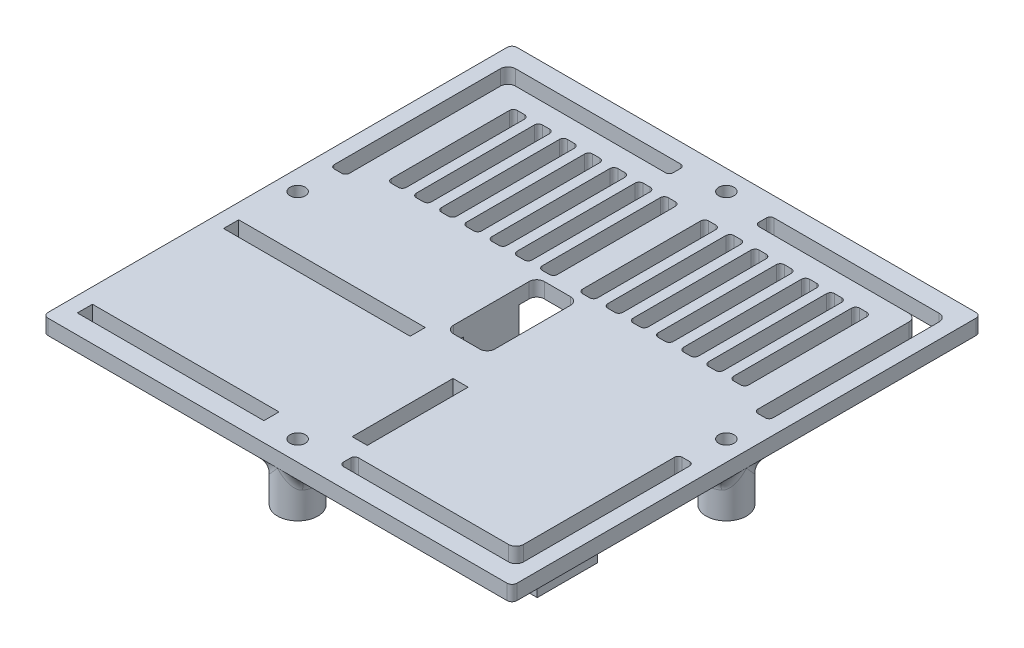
SolidWorks part; units mm, degrees
ref_plane "Front Plane" through (0, 0, 0) normal (0, 0, 1) x (1, 0, 0)
ref_plane "Top Plane" through (0, 0, 0) normal (0, 1, 0) x (1, 0, 0)
ref_plane "Right Plane" through (0, 0, 0) normal (1, 0, 0) x (0, 0, -1)
sketch "Sketch1" plane through (0, 0, 0) normal (0, 1, 0) x (1, 0, 0)
  line L0 (0, 0) -> (0, 42.5) construction
  circle A0 centre (0, 42.5) radius 4
  circle A1 centre (0, 0) radius 42.5 construction
  circle A2 centre (42.5, 0) radius 4
  circle A3 centre (0, -42.5) radius 4
  circle A4 centre (-42.5, 0) radius 4
  point P13 (0, 0)
  dimension "D1" = 8
  dimension "D2" = 42.5
  dimension "D3" = 4
extrude "Boss-Extrude1" add sketch "Sketch1" along normal blind 22
sketch "Sketch3" plane through (0, 0, 0) normal (0, -1, 0) x (-1, 0, 0)
  circle A0 centre (0, 42.5) radius 2.6
  circle A1 centre (0, 42.5) radius 4
  circle A2 centre (0, 42.5) radius 4 construction
  circle A3 centre (0, 0) radius 42.5 construction
  circle A4 centre (42.5, 0) radius 2.6
  circle A5 centre (42.5, 0) radius 4
  circle A6 centre (0, -42.5) radius 2.6
  circle A7 centre (0, -42.5) radius 4
  circle A8 centre (-42.5, 0) radius 2.6
  circle A9 centre (-42.5, 0) radius 4
  point P21 (0, 0)
  dimension "D1" = 5.2
  dimension "D2" = 4
extrude "Boss-Extrude2" add sketch "Sketch3" along normal blind 2
sketch "Sketch4" plane through (0, 22, 0) normal (0, 1, 0) x (1, 0, 0)
  circle A0 centre (0, 0) radius 42.5 construction
  circle A1 centre (0, -42.5) radius 1.5
  circle A2 centre (-42.5, 0) radius 1.5
  circle A3 centre (0, 42.5) radius 1.5
  circle A4 centre (42.5, 0) radius 1.5
  point P15 (0, 0)
  dimension "D1" = 3
  dimension "D2" = 4
extrude "Cut-Extrude1" cut sketch "Sketch4" against normal up to surface (22 mm away)
ref_plane "Plane1" through (0, 1.25, 0) normal (0, -1, 0) x (-1, 0, 0)
sketch "Sketch5" plane through (0, 1.25, 0) normal (0, -1, 0) x (-1, 0, 0)
  line L1 (46.5, 46.5) -> (-46.5, 46.5)
  line L2 (46.5, 46.5) -> (46.5, -46.5)
  line L3 (46.5, -46.5) -> (-46.5, -46.5)
  line L4 (-46.5, 46.5) -> (-46.5, -46.5)
  line L5 (46.5, 46.5) -> (-46.5, -46.5) construction
  line L6 (46.5, -46.5) -> (-46.5, 46.5) construction
  circle A0 centre (-42.5, 0) radius 4 construction
  circle A3 centre (0, -42.5) radius 4 construction
  point P0 (0, 0)
extrude "Boss-Extrude3" add sketch "Sketch5" against normal blind 3
sketch "Sketch7" plane through (0, 1.25, 0) normal (0, -1, 0) x (1, 0, 0)
  line L0 (0, 5.5) -> (0, -5.5) construction
  line L1 (0, 0) -> (4.1, 0) construction
  line L2 (4.1, 5.5) -> (5.6, 5.5)
  line L3 (4.1, 5.5) -> (-4.1, 5.5) construction
  line L4 (4.1, 5.5) -> (4.1, -5.5)
  line L5 (4.1, -5.5) -> (-4.1, -5.5) construction
  line L6 (-4.1, 5.5) -> (-4.1, -5.5)
  line L9 (4.1, 5.5) -> (-4.1, -5.5) construction
  line L10 (4.1, -5.5) -> (-4.1, 5.5) construction
  line L11 (5.6, 5.5) -> (5.6, -5.5)
  line L12 (5.6, -5.5) -> (4.1, -5.5)
  line L13 (-4.1, 5.5) -> (-5.6, 5.5)
  line L14 (-5.6, 5.5) -> (-5.6, -5.5)
  line L15 (-5.6, -5.5) -> (-4.1, -5.5)
  line L16 (-4.1, -5.5) -> (-4.0641, -5.4662)
  dimension "D1" = 5.5
  dimension "D2" = 4.1
  dimension "D3" = 1.5
  dimension "D4" = 1.5
extrude "Boss-Extrude4" add sketch "Sketch7" along normal blind 10 contours L6 L13 L14 L15 | L11 L12 L4 L2
sketch "Sketch8" plane through (0, 1.25, 0) normal (0, -1, 0) x (1, 0, 0)
  line L0 (-46.5, 46.5) -> (-46.5, 0) construction
  line L1 (-46.5, 39.7) -> (-6.5, 39.7)
  line L2 (-46.5, 39.7) -> (-46.5, 36.7)
  line L3 (-46.5, 36.7) -> (-6.5, 36.7)
  line L4 (-6.5, 39.7) -> (-6.5, 36.7)
  line L5 (0, 46.5) -> (-46.5, 46.5) construction
  line L6 (-46.5, 26.7) -> (3.5, 26.7) construction
  line L7 (-46.5, 13.7) -> (-46.5, 16.7)
  line L8 (-6.5, 13.7) -> (-6.5, 16.7)
  line L9 (-46.5, 13.7) -> (-6.5, 13.7)
  line L10 (-46.5, 16.7) -> (-6.5, 16.7)
  line L12 (5, 16.7) -> (2, 16.7)
  line L13 (5, 16.7) -> (5, 36.7)
  line L14 (5, 36.7) -> (2, 36.7)
  line L15 (2, 16.7) -> (2, 36.7)
  line L16 (5, 16.7) -> (2, 36.7) construction
  line L17 (5, 36.7) -> (2, 16.7) construction
  point P4 (0, 0)
  point P5 (40.5, 0)
  point P6 (0, 0)
  point P14 (44.5, 0)
  dimension "D3" = 40
  dimension "D4" = 10
  dimension "D5" = 50
  dimension "D1" = 9.8
  dimension "D2" = 3
  dimension "D6" = 3
  dimension "D7" = 20
extrude "Boss-Extrude5" add sketch "Sketch8" along normal blind 3
sketch "Sketch9" plane through (0, -8.75, 0) normal (0, -1, 0) x (1, 0, 0)
  line L0 (0, 0) -> (0, -5.5) construction
  line L1 (-5.6, -5.5) -> (5.6, -5.5)
  line L2 (-5.6, -5.5) -> (-5.6, 5.5)
  line L3 (-5.6, 5.5) -> (5.6, 5.5)
  line L4 (5.6, -5.5) -> (5.6, 5.5)
  line L5 (4.1, 5.5) -> (4.1, -5.5) construction
  line L6 (4.1, -3.1) -> (-4.1, -3.1)
  line L7 (4.1, -3.1) -> (4.1, -4.2)
  line L8 (4.1, -4.2) -> (-4.1, -4.2)
  line L9 (-4.1, -3.1) -> (-4.1, -4.2)
  line L10 (4.1, -3.1) -> (-4.1, -4.2) construction
  line L11 (4.1, -4.2) -> (-4.1, -3.1) construction
  line L12 (0, 0) -> (4.1, 0) construction
  line L13 (4.1, 4.2) -> (-4.1, 3.1) construction
  line L14 (4.1, 3.1) -> (-4.1, 4.2) construction
  line L15 (-4.1, 3.1) -> (-4.1, 4.2)
  line L16 (4.1, 3.1) -> (4.1, 4.2)
  line L17 (4.1, 4.2) -> (-4.1, 4.2)
  line L18 (4.1, 3.1) -> (-4.1, 3.1)
  point P9 (0, -3.65)
  dimension "D1" = 1.1
  dimension "D2" = 3.1
extrude "Boss-Extrude6" add sketch "Sketch9" along normal blind 1.5
sketch "Sketch10" plane through (0, 1.25, 0) normal (0, -1, 0) x (1, 0, 0)
  line L0 (2, 26.7) -> (-46.5, 26.7) construction
  line L1 (2, 36.7) -> (2, 16.7) construction
  line L2 (-46.5, 36.7) -> (-46.5, 16.7) construction
  line L3 (46.5, 0) -> (46.5, 46.5) construction
  line L4 (-46.5, 46.5) -> (-46.5, 39.7) construction
  line L5 (8.5, -40.45) -> (8.5, -41.95)
  line L6 (-6.5, 39.7) -> (-43.5, 39.7)
  line L7 (-6.5, 39.7) -> (-6.5, 42.7)
  line L8 (43.5, 39.7) -> (43.5, 8.25)
  line L9 (-6.5, 42.7) -> (-43.5, 42.7)
  line L10 (-43.5, 39.7) -> (-43.5, 42.7)
  line L11 (-43.5, 13.7) -> (-43.5, 10.7)
  line L12 (-6.5, 13.7) -> (-43.5, 13.7)
  line L13 (-6.5, 13.7) -> (-6.5, 10.7)
  line L14 (-6.5, 10.7) -> (-43.5, 10.7)
  line L15 (2, 26.7) -> (5, 26.7) construction
  line L16 (5, 16.7) -> (5, 36.7) construction
  line L17 (5, 16.7) -> (5, 36.7) construction
  line L18 (5, 36.7) -> (8, 36.7)
  line L19 (5, 36.7) -> (5, 16.7)
  line L20 (5, 16.7) -> (8, 16.7)
  line L21 (8, 36.7) -> (8, 16.7)
  line L22 (4.1, 5.5) -> (4.1, -5.5) construction
  line L23 (-2.6, -9) -> (2.6, -9)
  line L24 (-4.1, -7.5) -> (-4.1, 7.5)
  line L25 (-2.6, 9) -> (2.6, 9)
  line L26 (4.1, -7.5) -> (4.1, 7.5)
  line L27 (-4.1, -9) -> (4.1, 9) construction
  line L28 (-4.1, 9) -> (4.1, -9) construction
  line L29 (0, 0) -> (46.5, 0) construction
  line L30 (42.75, 7.5) -> (41.25, 7.5)
  line L31 (40.5, 38.2) -> (40.5, 8.25)
  line L32 (42.75, -7.5) -> (41.25, -7.5)
  line L33 (39, 39.7) -> (9.25, 39.7)
  line L34 (43.5, 39.7) -> (43.5, 41.2)
  line L35 (42, 42.7) -> (9.25, 42.7)
  line L36 (8.5, 40.45) -> (8.5, 41.95)
  line L37 (43.5, -39.7) -> (43.5, -41.2)
  line L38 (43.5, -39.7) -> (43.5, -8.25)
  line L39 (40.5, -38.2) -> (40.5, -8.25)
  line L40 (42, -42.7) -> (9.25, -42.7)
  line L41 (39, -39.7) -> (9.25, -39.7)
  line L42 (0, 0) -> (0, -42.5) construction
  line L43 (-39, -39.7) -> (-9.25, -39.7)
  line L44 (-42, -42.7) -> (-9.25, -42.7)
  line L45 (-40.5, -38.2) -> (-40.5, -8.25)
  line L46 (-43.5, -39.7) -> (-43.5, -8.25)
  line L47 (-43.5, -39.7) -> (-43.5, -41.2)
  line L48 (-42.75, -7.5) -> (-41.25, -7.5)
  line L49 (-8.5, -40.45) -> (-8.5, -41.95)
  arc A0 (-2.6, -9) -> (-4.1, -7.5) centre (-2.6, -7.5) cw
  arc A1 (2.6, -9) -> (4.1, -7.5) centre (2.6, -7.5) ccw
  arc A2 (2.6, 9) -> (4.1, 7.5) centre (2.6, 7.5) cw
  arc A3 (-4.1, 7.5) -> (-2.6, 9) centre (-2.6, 7.5) cw
  circle A4 centre (42.5, 0) radius 4 construction
  arc A5 (43.5, 41.2) -> (42, 42.7) centre (42, 41.2) ccw
  arc A6 (39, 39.7) -> (40.5, 38.2) centre (39, 38.2) cw
  arc A7 (9.25, 42.7) -> (8.5, 41.95) centre (9.25, 41.95) ccw
  arc A8 (9.25, 39.7) -> (8.5, 40.45) centre (9.25, 40.45) cw
  arc A9 (41.25, 7.5) -> (40.5, 8.25) centre (41.25, 8.25) cw
  arc A10 (43.5, 8.25) -> (42.75, 7.5) centre (42.75, 8.25) cw
  arc A11 (9.25, -39.7) -> (8.5, -40.45) centre (9.25, -40.45) ccw
  arc A12 (9.25, -42.7) -> (8.5, -41.95) centre (9.25, -41.95) cw
  arc A13 (41.25, -7.5) -> (40.5, -8.25) centre (41.25, -8.25) ccw
  arc A14 (43.5, -8.25) -> (42.75, -7.5) centre (42.75, -8.25) ccw
  arc A15 (39, -39.7) -> (40.5, -38.2) centre (39, -38.2) ccw
  arc A16 (43.5, -41.2) -> (42, -42.7) centre (42, -41.2) cw
  arc A17 (-43.5, -41.2) -> (-42, -42.7) centre (-42, -41.2) ccw
  arc A18 (-39, -39.7) -> (-40.5, -38.2) centre (-39, -38.2) cw
  arc A19 (-43.5, -8.25) -> (-42.75, -7.5) centre (-42.75, -8.25) cw
  arc A20 (-41.25, -7.5) -> (-40.5, -8.25) centre (-41.25, -8.25) cw
  arc A21 (-9.25, -42.7) -> (-8.5, -41.95) centre (-9.25, -41.95) ccw
  arc A22 (-9.25, -39.7) -> (-8.5, -40.45) centre (-9.25, -40.45) cw
  point P29 (0, 0)
  point P61 (43.5, 42.7)
  point P64 (40.5, 39.7)
  point P67 (8.5, 42.7)
  point P72 (40.5, 7.5)
  point P75 (43.5, 7.5)
  dimension "D5" = 1.5
  dimension "D13" = 1.5
  dimension "D14" = 0.75
  dimension "D1" = 3
  dimension "D2" = 3
  dimension "D3" = 3
  dimension "D4" = 18
  dimension "D6" = 3
  dimension "D7" = 3
  dimension "D8" = 32.2
  dimension "D9" = 7.5
  dimension "D10" = 3
  dimension "D11" = 35
  dimension "D12" = 32.2
extrude "Cut-Extrude2" cut sketch "Sketch10" against normal through all
fillet "Fillet1" radius 5 2 edges at (-5.6, 1.25, 0) (5.6, 1.25, 0)
sketch "Sketch11" plane through (-46.5, 0, 0) normal (-1, 0, 0) x (0, 0, 1)
  line L1 (-46.5, 4.25) -> (46.5, 4.25)
  line L2 (-46.5, 4.25) -> (-46.5, 22)
  line L3 (-46.5, 22) -> (46.5, 22)
  line L4 (46.5, 4.25) -> (46.5, 22)
extrude "Cut-Extrude3" cut sketch "Sketch11" against normal through all both and the other way through all
sketch "Sketch12" plane through (0, -2, 0) normal (0, -1, 0) x (1, 0, 0)
  line L0 (0, 0) -> (0, 42.5) construction
  circle A0 centre (0, 42.5) radius 4
  circle A1 centre (0, 42.5) radius 2.6
  circle A2 centre (42.5, 0) radius 2.6
  circle A3 centre (42.5, 0) radius 4
  circle A4 centre (0, -42.5) radius 2.6
  circle A5 centre (0, -42.5) radius 4
  circle A6 centre (-42.5, 0) radius 2.6
  circle A7 centre (-42.5, 0) radius 4
  point P19 (0, 0)
  dimension "D1" = 5.2
  dimension "D2" = 8
  dimension "D3" = 4
extrude "Boss-Extrude7" add sketch "Sketch12" along normal blind 5
sketch "Sketch13" plane through (0, 1.25, 0) normal (0, -1, 0) x (1, 0, 0)
  line L0 (-40.5, -38.2) -> (-40.5, -8.25) construction
  line L1 (-23.2941, -35.7) -> (-24.7059, -35.7)
  line L2 (-22.5, -34.9059) -> (-22.5, -11.4941)
  line L3 (-23.2941, -10.7) -> (-24.7059, -10.7)
  line L4 (-25.5, -34.9059) -> (-25.5, -11.4941)
  line L5 (-9.25, -39.7) -> (-39, -39.7) construction
  line L6 (-17.5, -34.9059) -> (-17.5, -11.4941)
  line L7 (-18.2941, -10.7) -> (-19.7059, -10.7)
  line L8 (-20.5, -34.9059) -> (-20.5, -11.4941)
  line L9 (-18.2941, -35.7) -> (-19.7059, -35.7)
  line L10 (-12.5, -34.9059) -> (-12.5, -11.4941)
  line L11 (-13.2941, -10.7) -> (-14.7059, -10.7)
  line L12 (-15.5, -34.9059) -> (-15.5, -11.4941)
  line L13 (-13.2941, -35.7) -> (-14.7059, -35.7)
  line L14 (-7.5, -34.9059) -> (-7.5, -11.4941)
  line L15 (-8.2941, -10.7) -> (-9.7059, -10.7)
  line L16 (-10.5, -34.9059) -> (-10.5, -11.4941)
  line L17 (-8.2941, -35.7) -> (-9.7059, -35.7)
  line L18 (-2.5, -34.9059) -> (-2.5, -11.4941)
  line L19 (-3.2941, -10.7) -> (-4.7059, -10.7)
  line L20 (-5.5, -34.9059) -> (-5.5, -11.4941)
  line L21 (-3.2941, -35.7) -> (-4.7059, -35.7)
  line L22 (-27.4684, -34.9059) -> (-27.4684, -11.4941)
  line L23 (-28.2625, -10.7) -> (-29.6744, -10.7)
  line L24 (-28.2625, -35.7) -> (-29.6744, -35.7)
  line L25 (-30.4684, -34.9059) -> (-30.4684, -11.4941)
  line L26 (-32.4369, -34.9059) -> (-32.4369, -11.4941)
  line L27 (-33.2309, -10.7) -> (-34.6428, -10.7)
  line L28 (-33.2309, -35.7) -> (-34.6428, -35.7)
  line L29 (-35.4369, -34.9059) -> (-35.4369, -11.4941)
  line L30 (0, 0) -> (0, -42.5) construction
  line L31 (35.4369, -34.9059) -> (35.4369, -11.4941)
  line L32 (33.2309, -35.7) -> (34.6428, -35.7)
  line L33 (33.2309, -10.7) -> (34.6428, -10.7)
  line L34 (32.4369, -34.9059) -> (32.4369, -11.4941)
  line L35 (30.4684, -34.9059) -> (30.4684, -11.4941)
  line L36 (28.2625, -35.7) -> (29.6744, -35.7)
  line L37 (28.2625, -10.7) -> (29.6744, -10.7)
  line L38 (27.4684, -34.9059) -> (27.4684, -11.4941)
  line L39 (3.2941, -35.7) -> (4.7059, -35.7)
  line L40 (5.5, -34.9059) -> (5.5, -11.4941)
  line L41 (3.2941, -10.7) -> (4.7059, -10.7)
  line L42 (2.5, -34.9059) -> (2.5, -11.4941)
  line L43 (8.2941, -35.7) -> (9.7059, -35.7)
  line L44 (10.5, -34.9059) -> (10.5, -11.4941)
  line L45 (8.2941, -10.7) -> (9.7059, -10.7)
  line L46 (7.5, -34.9059) -> (7.5, -11.4941)
  line L47 (13.2941, -35.7) -> (14.7059, -35.7)
  line L48 (15.5, -34.9059) -> (15.5, -11.4941)
  line L49 (13.2941, -10.7) -> (14.7059, -10.7)
  line L50 (12.5, -34.9059) -> (12.5, -11.4941)
  line L51 (18.2941, -35.7) -> (19.7059, -35.7)
  line L52 (20.5, -34.9059) -> (20.5, -11.4941)
  line L53 (18.2941, -10.7) -> (19.7059, -10.7)
  line L54 (17.5, -34.9059) -> (17.5, -11.4941)
  line L55 (25.5, -34.9059) -> (25.5, -11.4941)
  line L56 (23.2941, -10.7) -> (24.7059, -10.7)
  line L57 (22.5, -34.9059) -> (22.5, -11.4941)
  line L58 (23.2941, -35.7) -> (24.7059, -35.7)
  arc A0 (-34.6428, -35.7) -> (-35.4369, -34.9059) centre (-34.6428, -34.9059) cw
  arc A1 (-32.4369, -34.9059) -> (-33.2309, -35.7) centre (-33.2309, -34.9059) cw
  arc A2 (-34.6428, -10.7) -> (-35.4369, -11.4941) centre (-34.6428, -11.4941) ccw
  arc A3 (-32.4369, -11.4941) -> (-33.2309, -10.7) centre (-33.2309, -11.4941) ccw
  arc A4 (-29.6744, -35.7) -> (-30.4684, -34.9059) centre (-29.6744, -34.9059) cw
  arc A5 (-27.4684, -34.9059) -> (-28.2625, -35.7) centre (-28.2625, -34.9059) cw
  arc A6 (-29.6744, -10.7) -> (-30.4684, -11.4941) centre (-29.6744, -11.4941) ccw
  arc A7 (-27.4684, -11.4941) -> (-28.2625, -10.7) centre (-28.2625, -11.4941) ccw
  arc A8 (-17.5, -34.9059) -> (-18.2941, -35.7) centre (-18.2941, -34.9059) cw
  arc A9 (-20.5, -34.9059) -> (-19.7059, -35.7) centre (-19.7059, -34.9059) ccw
  arc A10 (-19.7059, -10.7) -> (-20.5, -11.4941) centre (-19.7059, -11.4941) ccw
  arc A11 (-17.5, -11.4941) -> (-18.2941, -10.7) centre (-18.2941, -11.4941) ccw
  arc A12 (-15.5, -34.9059) -> (-14.7059, -35.7) centre (-14.7059, -34.9059) ccw
  arc A13 (-12.5, -34.9059) -> (-13.2941, -35.7) centre (-13.2941, -34.9059) cw
  arc A14 (-14.7059, -10.7) -> (-15.5, -11.4941) centre (-14.7059, -11.4941) ccw
  arc A15 (-12.5, -11.4941) -> (-13.2941, -10.7) centre (-13.2941, -11.4941) ccw
  arc A16 (-10.5, -34.9059) -> (-9.7059, -35.7) centre (-9.7059, -34.9059) ccw
  arc A17 (-7.5, -34.9059) -> (-8.2941, -35.7) centre (-8.2941, -34.9059) cw
  arc A18 (-9.7059, -10.7) -> (-10.5, -11.4941) centre (-9.7059, -11.4941) ccw
  arc A19 (-7.5, -11.4941) -> (-8.2941, -10.7) centre (-8.2941, -11.4941) ccw
  arc A20 (-5.5, -34.9059) -> (-4.7059, -35.7) centre (-4.7059, -34.9059) ccw
  arc A21 (-2.5, -34.9059) -> (-3.2941, -35.7) centre (-3.2941, -34.9059) cw
  arc A22 (-4.7059, -10.7) -> (-5.5, -11.4941) centre (-4.7059, -11.4941) ccw
  arc A23 (-2.5, -11.4941) -> (-3.2941, -10.7) centre (-3.2941, -11.4941) ccw
  arc A24 (2.5, -11.4941) -> (3.2941, -10.7) centre (3.2941, -11.4941) cw
  arc A25 (4.7059, -10.7) -> (5.5, -11.4941) centre (4.7059, -11.4941) cw
  arc A26 (2.5, -34.9059) -> (3.2941, -35.7) centre (3.2941, -34.9059) ccw
  arc A27 (5.5, -34.9059) -> (4.7059, -35.7) centre (4.7059, -34.9059) cw
  arc A28 (7.5, -11.4941) -> (8.2941, -10.7) centre (8.2941, -11.4941) cw
  arc A29 (9.7059, -10.7) -> (10.5, -11.4941) centre (9.7059, -11.4941) cw
  arc A30 (7.5, -34.9059) -> (8.2941, -35.7) centre (8.2941, -34.9059) ccw
  arc A31 (10.5, -34.9059) -> (9.7059, -35.7) centre (9.7059, -34.9059) cw
  arc A32 (12.5, -11.4941) -> (13.2941, -10.7) centre (13.2941, -11.4941) cw
  arc A33 (14.7059, -10.7) -> (15.5, -11.4941) centre (14.7059, -11.4941) cw
  arc A34 (12.5, -34.9059) -> (13.2941, -35.7) centre (13.2941, -34.9059) ccw
  arc A35 (15.5, -34.9059) -> (14.7059, -35.7) centre (14.7059, -34.9059) cw
  arc A36 (17.5, -11.4941) -> (18.2941, -10.7) centre (18.2941, -11.4941) cw
  arc A37 (19.7059, -10.7) -> (20.5, -11.4941) centre (19.7059, -11.4941) cw
  arc A38 (20.5, -34.9059) -> (19.7059, -35.7) centre (19.7059, -34.9059) cw
  arc A39 (17.5, -34.9059) -> (18.2941, -35.7) centre (18.2941, -34.9059) ccw
  arc A40 (27.4684, -11.4941) -> (28.2625, -10.7) centre (28.2625, -11.4941) cw
  arc A41 (29.6744, -10.7) -> (30.4684, -11.4941) centre (29.6744, -11.4941) cw
  arc A42 (27.4684, -34.9059) -> (28.2625, -35.7) centre (28.2625, -34.9059) ccw
  arc A43 (29.6744, -35.7) -> (30.4684, -34.9059) centre (29.6744, -34.9059) ccw
  arc A44 (32.4369, -11.4941) -> (33.2309, -10.7) centre (33.2309, -11.4941) cw
  arc A45 (34.6428, -10.7) -> (35.4369, -11.4941) centre (34.6428, -11.4941) cw
  arc A46 (32.4369, -34.9059) -> (33.2309, -35.7) centre (33.2309, -34.9059) ccw
  arc A47 (34.6428, -35.7) -> (35.4369, -34.9059) centre (34.6428, -34.9059) ccw
  arc A48 (-24.7059, -10.7) -> (-25.5, -11.4941) centre (-24.7059, -11.4941) ccw
  arc A49 (-24.7059, -35.7) -> (-25.5, -34.9059) centre (-24.7059, -34.9059) cw
  arc A50 (-23.2941, -35.7) -> (-22.5, -34.9059) centre (-23.2941, -34.9059) ccw
  arc A51 (-22.5, -11.4941) -> (-23.2941, -10.7) centre (-23.2941, -11.4941) ccw
  arc A52 (22.5, -34.9059) -> (23.2941, -35.7) centre (23.2941, -34.9059) ccw
  arc A53 (25.5, -34.9059) -> (24.7059, -35.7) centre (24.7059, -34.9059) cw
  arc A54 (23.2941, -10.7) -> (22.5, -11.4941) centre (23.2941, -11.4941) ccw
  arc A55 (25.5, -11.4941) -> (24.7059, -10.7) centre (24.7059, -11.4941) ccw
  circle A56 centre (-42.5, 0) radius 1.5
  circle A57 centre (0, -42.5) radius 1.5
  circle A58 centre (0, 42.5) radius 1.5
  circle A59 centre (42.5, 0) radius 1.5
  point P8 (-24.125, -39.7)
  point P163 (-25.5, -10.7)
  point P166 (-25.5, -35.7)
  point P169 (-22.5, -35.7)
  point P172 (-22.5, -10.7)
  point P175 (22.5, -35.7)
  point P178 (25.5, -35.7)
  point P181 (22.5, -10.7)
  point P184 (25.5, -10.7)
  dimension "D7" = 0.7941
  dimension "D8" = 0.7941
  dimension "D1" = 25
  dimension "D2" = 3
  dimension "D3" = 15
  dimension "D4" = 4
  dimension "D5" = 5
  dimension "D6" = 3
extrude "Cut-Extrude4" cut sketch "Sketch13" against normal through all
fillet "Fillet2" radius 1 4 edges at (46.5, 2.75, -46.5) (-46.5, 2.75, -46.5) (-46.5, 2.75, 46.5) (46.5, 2.75, 46.5)
fillet "Fillet3" radius 3 4 edges at (42.5, 1.25, 4) (0, 1.25, 46.5) (-42.5, 1.25, 4) (0, 1.25, -38.5)
sketch "Sketch14" plane through (0, 1.25, 0) normal (0, -1, 0) x (1, 0, 0)
  line L0 (46.5, 5.7446) -> (46.5, 45.5) construction
  line L1 (33.5, 19.5) -> (36.5, 19.5)
  line L2 (33.5, 19.5) -> (33.5, 31.5)
  line L3 (33.5, 31.5) -> (36.5, 31.5)
  line L4 (36.5, 19.5) -> (36.5, 31.5)
  line L5 (45.5, 46.5) -> (5.7446, 46.5) construction
  point P4 (36.5, 25.5)
  dimension "D1" = 12
  dimension "D2" = 3
  dimension "D3" = 10
  dimension "D4" = 15
extrude "Boss-Extrude8" add sketch "Sketch14" along normal up to surface (11.5 mm away)
fillet "Fillet4" radius 3 3 edges at (35, 1.25, 19.5) (33.5, 1.25, 25.5) (35, 1.25, 31.5)
sketch "Sketch15" plane through (36.5, 0, 0) normal (1, 0, 0) x (0, 0, -1)
  line L0 (-25.5, -10.25) -> (-25.5, 1.25) construction
  line L1 (-31.5, -10.25) -> (-19.5, -10.25) construction
  line L2 (-16.5, 1.25) -> (-34.5, 1.25) construction
  line L3 (-30.3, -0.75) -> (-28.3, -0.75)
  line L4 (-20.7, -0.75) -> (-22.7, -0.75)
  line L5 (-20.7, -0.75) -> (-20.7, -7.75)
  line L6 (-20.7, -7.75) -> (-22.7, -7.75)
  line L7 (-22.7, -0.75) -> (-22.7, -7.75)
  line L8 (-28.3, -0.75) -> (-28.3, -7.75)
  line L9 (-30.3, -0.75) -> (-30.3, -7.75)
  line L10 (-30.3, -7.75) -> (-28.3, -7.75)
  dimension "D1" = 2
  dimension "D2" = 2.8
  dimension "D3" = 2.5
  dimension "D4" = 7
extrude "Cut-Extrude6" cut sketch "Sketch15" against normal blind 10
fillet "Fillet5" radius 2 1 edges at (36.5, 1.25, 25.5)
